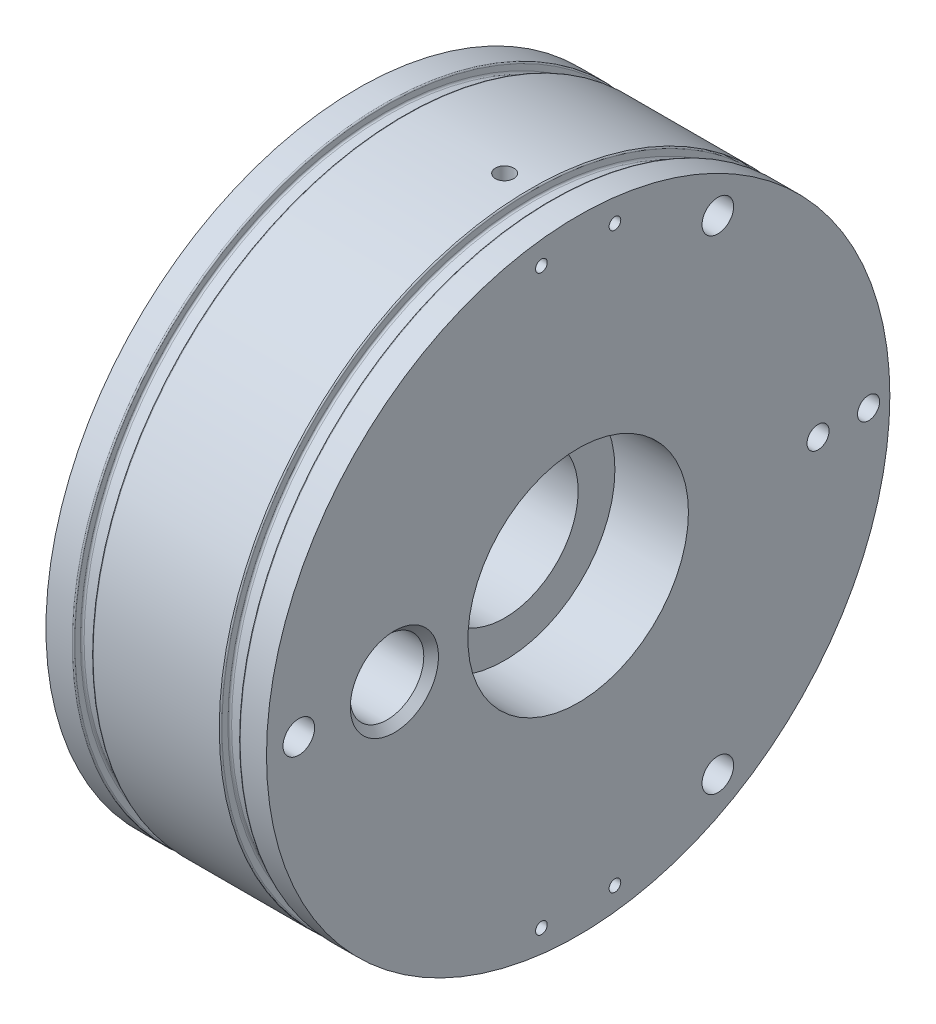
SolidWorks part; units mm, degrees
ref_plane "Front Plane" through (0, 0, 0) normal (0, 0, 1) x (1, 0, 0)
ref_plane "Top Plane" through (0, 0, 0) normal (0, 1, 0) x (1, 0, 0)
ref_plane "Right Plane" through (0, 0, 0) normal (1, 0, 0) x (0, 0, -1)
sketch "Sketch1" plane through (0, 0, 0) normal (1, 0, 0) x (0, 0, -1)
  circle A0 centre (0, 0) radius 42.4
  dimension "D1" = 84.8
extrude "Boss-Extrude1" add sketch "Sketch1" along normal blind 30
ref_plane "Plane1" through (15, 0, 0) normal (1, 0, 0) x (0, 0, -1)
ref_plane "Plane2" through (25, 0, 0) normal (1, 0, 0) x (0, 0, -1)
ref_plane "Plane3" through (5, 0, 0) normal (1, 0, 0) x (0, 0, -1)
sketch "Sketch2" plane through (30, 0, 0) normal (1, 0, 0) x (0, 0, -1)
  circle A0 centre (0, 0) radius 10
extrude "Cut-Extrude1" cut sketch "Sketch2" against normal through all
sketch "Sketch3" plane through (0, 0, 0) normal (-1, 0, 0) x (0, 0, 1)
  circle A0 centre (38, 0) radius 3.1
  dimension "D1" = 38
extrude "Cut-Extrude2" cut sketch "Sketch3" against normal blind 1.5
hole_wizard "Ø4.3 (4.3) Diameter Hole1" positions "Sketch5" profile "Sketch4" hole size "Ø4.3" standard "Ansi Metric"
sketch "Sketch5" plane through (30, 0, 0) normal (1, 0, 0) x (0, 0, -1)
  circle A0 centre (-38, 0) radius 3.1 construction
  point P0 (-38, 0)
sketch "Sketch4" plane through (30, 0, 38) normal (0, 1, 0) x (0, 0, -1)
  line L0 (0, 0) -> (0, 30)
  line L1 (0, 30) -> (2.15, 30)
  line L2 (2.15, 30) -> (2.15, 0)
  line L5 (2.15, 0) -> (0, 0)
  line L11 (0, -6.35) -> (0, 107.95) construction
  dimension "Thru Hole Dia." = 4.3
  dimension "Thru Hole Depth" = 30
pattern_circular "CirPattern1" count 3 over 360 about axis through (0, 0, 0) along (1, 0, 0) of "Ø4.3 (4.3) Diameter Hole1", "Cut-Extrude2"
sketch "Sketch6" plane through (30, 0, 0) normal (1, 0, 0) x (0, 0, -1)
  circle A0 centre (-25, 0) radius 5
  dimension "D1" = 25
extrude "Cut-Extrude3" cut sketch "Sketch6" against normal through all
chamfer "Chamfer1" distance 1 angle 45 2 edges at (30, 0, 20) (0, 0, 20)
sketch "Sketch7" plane through (30, 0, 0) normal (1, 0, 0) x (0, 0, -1)
  circle A0 centre (32.63, 0) radius 1.5
  dimension "D1" = 32.63
extrude "Cut-Extrude4" cut sketch "Sketch7" against normal blind 10
sketch "Sketch8" plane through (30, 0, 0) normal (1, 0, 0) x (0, 0, -1)
  circle A0 centre (0, 0) radius 15
extrude "Cut-Extrude5" cut sketch "Sketch8" against normal blind 10
sketch "Sketch9" plane through (0, 0, 0) normal (0, 0, 1) x (1, 0, 0)
  line L0 (30, 42.4) -> (0, 42.4) construction
  line L1 (23.7555, 43.6446) -> (26.2445, 43.6446)
  line L2 (23.7555, 43.6446) -> (23.7555, 41.4094)
  line L3 (24.0095, 41.1554) -> (25.9905, 41.1554)
  line L4 (26.2445, 43.6446) -> (26.2445, 41.4094)
  line L5 (23.7555, 43.6446) -> (26.2445, 41.1554) construction
  line L6 (23.7555, 41.1554) -> (26.2445, 43.6446) construction
  line L7 (30, -42.4) -> (30, 42.4) construction
  line L8 (3.7556, 43.7067) -> (6.2446, 43.7067)
  line L9 (3.7556, 43.7067) -> (3.7556, 41.4715)
  line L10 (4.0096, 41.2175) -> (5.9906, 41.2175)
  line L11 (6.2446, 43.7067) -> (6.2446, 41.4715)
  line L12 (3.7556, 43.7067) -> (6.2446, 41.2175) construction
  line L13 (3.7556, 41.2175) -> (6.2446, 43.7067) construction
  line L14 (25, 42.4) -> (5.0001, 42.4621) construction
  arc A0 (25.9905, 41.1554) -> (26.2445, 41.4094) centre (25.9905, 41.4094) ccw
  arc A1 (24.0095, 41.1554) -> (23.7555, 41.4094) centre (24.0095, 41.4094) cw
  arc A2 (5.9906, 41.2175) -> (6.2446, 41.4715) centre (5.9906, 41.4715) ccw
  arc A3 (4.0096, 41.2175) -> (3.7556, 41.4715) centre (4.0096, 41.4715) cw
  point P0 (25, 42.4)
  point P16 (5.0001, 42.4621)
  dimension "D4" = 0.254
  dimension "D1" = 2.4892
  dimension "D2" = 2.489
  dimension "D3" = 5
  dimension "D6" = 20
  dimension "D5" = 2
ref_axis "Axis1" through (0, 0, 0) along (1, 0, 0)
revolve "Cut-Revolve1" cut sketch "Sketch9" angle 360 about axis through (0, 0, 0) along (1, 0, 0)
fillet "Fillet1" radius 0.1778 4 edges at (26.2445, 0, 42.4) (23.7555, 0, -42.4) (6.2446, 0, 42.4) (3.7556, 0, -42.4)
ref_plane "Plane4" through (0, 42.4, 0) normal (0, 1, 0) x (-1, 0, 0)
hole_wizard "M3x0.5 Tapped Hole1" positions "Sketch11" profile "Sketch10" tap size "M3x0.5" standard "Ansi Metric"
sketch "Sketch11" plane through (0, 42.4, 0) normal (0, 1, 0) x (-1, 0, 0)
  line L0 (-30, 42.4) -> (-30, -42.4) construction
  point P1 (-20, 0)
  dimension "D1" = 10
sketch "Sketch10" plane through (20, 42.4, 0) normal (1, 0, 0) x (0, 0, 1)
  line L0 (0, 0) -> (0, 8.2511)
  line L1 (0, 8.2511) -> (1.25, 7.5)
  line L2 (1.25, 7.5) -> (1.25, 0)
  line L5 (1.25, 0) -> (0, 0)
  line L10 (0, 8.2511) -> (-1.25, 7.5) construction
  line L11 (0, -6.35) -> (0, 107.95) construction
  dimension "Tap Drill Dia." = 2.5
  dimension "Tap Drill Depth" = 7.5
  dimension "Drill Angle" = 118
pattern_circular "CirPattern2" count 2 every 270 about axis through (20, 0, 0) along (1, 0, 0) of "M3x0.5 Tapped Hole1"
hole_wizard "1/16 (0.0625) Diameter Hole1" positions "Sketch13" profile "Sketch12" hole size "1/16" standard "Ansi Inch"
sketch "Sketch13" plane through (30, 0, 0) normal (1, 0, 0) x (0, 0, -1)
  point P1 (-5, -39)
  point P3 (5, -39)
  dimension "D1" = 5
  dimension "D2" = 5
  dimension "D3" = 39
  dimension "D4" = 39
sketch "Sketch12" plane through (30, -39, 5) normal (0, 1, 0) x (0, 0, -1)
  line L0 (0, 0) -> (0, 30)
  line L1 (0, 30) -> (0.7937, 30)
  line L2 (0.7937, 30) -> (0.7937, 0)
  line L5 (0.7937, 0) -> (0, 0)
  line L11 (0, -6.35) -> (0, 107.95) construction
  dimension "Thru Hole Dia." = 1.5875
  dimension "Thru Hole Depth" = 30
sketch "Sketch14" plane through (30, 0, 0) normal (1, 0, 0) x (0, 0, -1)
  circle A0 centre (39.5, 0) radius 1.5
  circle A1 centre (0, 0) radius 42.4 construction
  dimension "D1" = 39.5
extrude "Cut-Extrude6" cut sketch "Sketch14" against normal blind 3
pattern_circular "CirPattern3" count 2 over 360 about axis through (0, 0, 0) along (1, 0, 0) of "1/16 (0.0625) Diameter Hole1"
